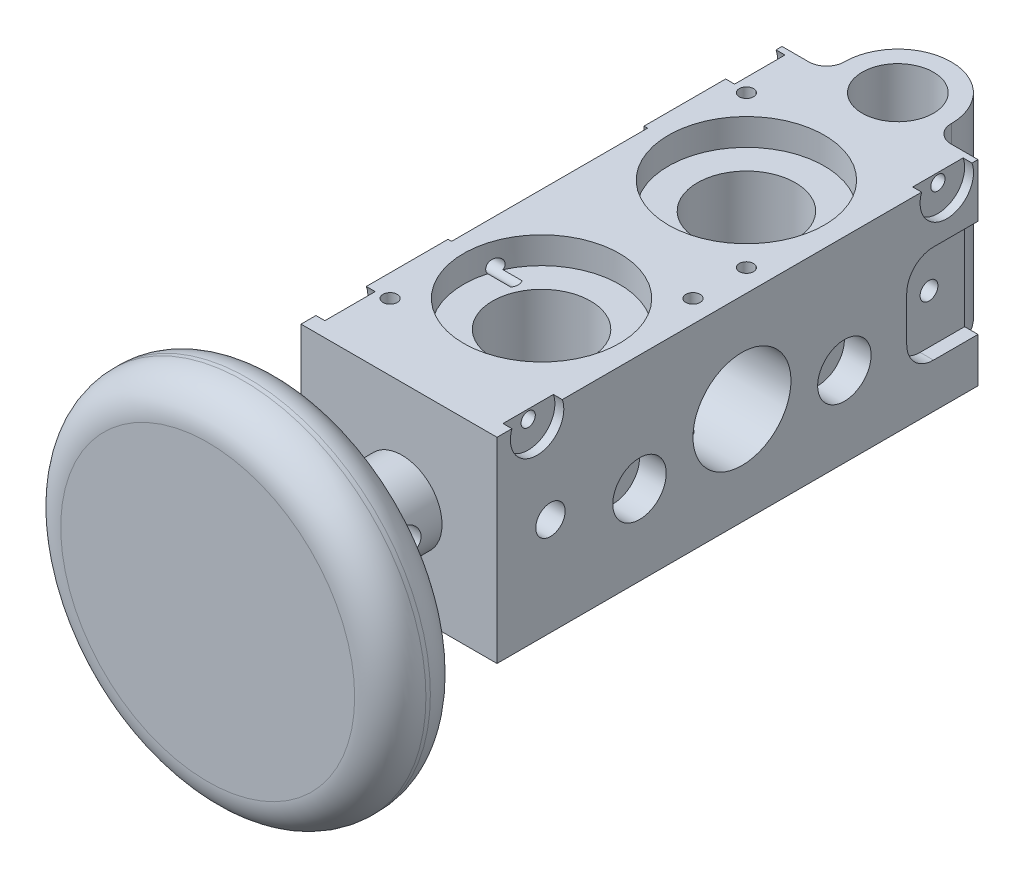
SolidWorks part; units mm, degrees
ref_plane "Plan de face" through (0, 0, 0) normal (0, 0, 1) x (1, 0, 0)
ref_plane "Plan de dessus" through (0, 0, 0) normal (0, 1, 0) x (1, 0, 0)
ref_plane "Plan de droite" through (0, 0, 0) normal (1, 0, 0) x (0, 0, -1)
sketch "Esquisse1" plane through (0, 0, 0) normal (0, 0, 1) x (1, 0, 0)
  line L1 (0, 0) -> (-22, 0)
  line L2 (0, 0) -> (0, 22)
  line L3 (0, 22) -> (-22, 22)
  line L4 (-22, 0) -> (-22, 22)
  dimension "D1" = 22
  dimension "D2" = 22
extrude "Extrusion1" add sketch "Esquisse1" along normal blind 54
sketch "Esquisse2" plane through (0, 0, 54) normal (0, 0, 1) x (1, 0, 0)
  circle A0 centre (-10.673, 10.4278) radius 4.5
  dimension "D1" = 9
extrude "Extrusion2" add sketch "Esquisse2" along normal blind 13
sketch "Esquisse3" plane through (0, 0, 67) normal (0, 0, 1) x (1, 0, 0)
  circle A0 centre (-10.9793, 10.2669) radius 20.5
  dimension "D1" = 41
extrude "Extrusion3" add sketch "Esquisse3" along normal blind 8.5
fillet "Congé1" radius 4 2 edges at (9.5207, 10.2669, 67) (9.5207, 10.2669, 75.5)
hole_wizard "Trou taraudé M4x0.71" positions "Esquisse8" profile "Esquisse7" tap size "M4x0.7" standard "ISO"
sketch "Esquisse8" plane through (0, 0, 0) normal (0, 1, 0) x (1, 0, 0)
  line L1 (-15.173, -54) -> (-15.173, -67) construction
  line L4 (5.5207, -67) -> (-27.4793, -67) construction
  point P1 (-10.673, -62.5)
  dimension "D1" = 4.5
  dimension "D2" = 4.5
sketch "Esquisse7" plane through (-10.673, 0, 62.5) normal (1, 0, 0) x (0, 0, -1)
  line L0 (0, 0) -> (0, 30.7669)
  line L1 (0, 30.7669) -> (1.65, 30.7669)
  line L2 (1.65, 30.7669) -> (1.65, 0)
  line L5 (1.65, 0) -> (0, 0)
  line L11 (0, -6.35) -> (0, 107.95) construction
  dimension "Diamètre du trou pour taraudage jusqu'au prochain" = 3.3
  dimension "Profondeur du trou pour taraudage jusqu'au prochain" = 30.7669
hole_wizard "Trou taraudé M4x0.72" positions "Esquisse10" profile "Esquisse9" tap size "M4x0.7" standard "ISO"
sketch "Esquisse10" plane through (0, 0, 0) normal (1, 0, 0) x (0, 0, -1)
  line L0 (-54, 14.9278) -> (-60.85, 14.9278) construction
  line L1 (-67, -6.2331) -> (-67, 26.7669) construction
  point P1 (-58, 10.4278)
  dimension "D1" = 4.5
  dimension "D2" = 9
sketch "Esquisse9" plane through (0, 10.4278, 58) normal (0, 1, 0) x (0, 0, -1)
  line L0 (0, 0) -> (0, 31.4793)
  line L1 (0, 31.4793) -> (1.65, 31.4793)
  line L2 (1.65, 31.4793) -> (1.65, 0)
  line L5 (1.65, 0) -> (0, 0)
  line L11 (0, -6.35) -> (0, 107.95) construction
  dimension "Diamètre du trou pour taraudage jusqu'au prochain" = 3.3
  dimension "Profondeur du trou pour taraudage jusqu'au prochain" = 31.4793
hole_wizard "Trou taraudé M4x0.73" positions "Esquisse12" profile "Esquisse11" tap size "M4x0.7" standard "ISO"
sketch "Esquisse12" plane through (0, 0, 0) normal (1, 0, 0) x (0, 0, -1)
  line L0 (-54, 22) -> (0, 22) construction
  line L1 (-54, 0) -> (-54, 22) construction
  point P0 (-48, 11)
  dimension "D1" = 11
  dimension "D2" = 6
sketch "Esquisse11" plane through (0, 11, 48) normal (0, 1, 0) x (0, 0, -1)
  line L0 (0, 0) -> (0, 11.0914)
  line L1 (0, 11.0914) -> (1.65, 10.1)
  line L2 (1.65, 10.1) -> (1.65, 0)
  line L5 (1.65, 0) -> (0, 0)
  line L10 (0, 11.0914) -> (-1.65, 10.1) construction
  line L11 (0, -6.35) -> (0, 107.95) construction
  dimension "Diamètre du trou pour taraudage" = 3.3
  dimension "Profondeur du trou pour taraudage" = 10.1
  dimension "Angle de pointe" = 118
hole_wizard "Trou taraudé M4x0.74" positions "Esquisse14" profile "Esquisse13" tap size "M4x0.7" standard "ISO"
sketch "Esquisse14" plane through (0, 0, 0) normal (0, -1, 0) x (1, 0, 0)
  line L0 (0, 54) -> (0, 0) construction
  line L1 (-22, 54) -> (0, 54) construction
  point P0 (-11, 51)
  dimension "D1" = 11
  dimension "D2" = 3
sketch "Esquisse13" plane through (-11, 0, 51) normal (1, 0, 0) x (0, 0, -1)
  line L0 (0, 0) -> (0, 11.0914)
  line L1 (0, 11.0914) -> (1.65, 10.1)
  line L2 (1.65, 10.1) -> (1.65, 0)
  line L5 (1.65, 0) -> (0, 0)
  line L10 (0, 11.0914) -> (-1.65, 10.1) construction
  line L11 (0, -6.35) -> (0, 107.95) construction
  dimension "Diamètre du trou pour taraudage" = 3.3
  dimension "Profondeur du trou pour taraudage" = 10.1
  dimension "Angle de pointe" = 118
sketch "Esquisse15" plane through (0, 0, 0) normal (0, -1, 0) x (1, 0, 0)
  line L0 (0, 54) -> (0, 0) construction
  line L1 (-22, 0) -> (0, 0) construction
  circle A0 centre (-11, -2) radius 6
  dimension "D3" = 12
  dimension "D1" = 11
  dimension "D2" = 2
extrude "Extrusion4" add sketch "Esquisse15" against normal up to surface (22 mm away)
fillet "Congé2" radius 2 2 edges at (-5.3431, 11, 0) (-16.6569, 11, 0)
sketch "Esquisse16" plane through (0, 0, 0) normal (0, -1, 0) x (1, 0, 0)
  circle A0 centre (-11, -2) radius 4
  arc A1 (-17, -2) -> (-5, -2) centre (-11, -2) ccw construction
  dimension "D1" = 8
extrude "Enlèv. mat.-Extru.1" cut sketch "Esquisse16" against normal through all
sketch "Esquisse22" plane through (-22, 0, 0) normal (-1, 0, 0) x (0, 0, 1)
  line L0 (0, 22) -> (0, 0) construction
  line L1 (54, 0) -> (0, 0) construction
  circle A0 centre (26.5, 11) radius 8.75
  dimension "D1" = 17.5
  dimension "D2" = 26.5
  dimension "D3" = 11
extrude "Enlèv. mat.-Extru.5" cut sketch "Esquisse22" against normal blind 3
sketch "Esquisse32" plane through (-19, 0, 0) normal (-1, 0, 0) x (0, 0, 1)
  circle A0 centre (26.5, 11) radius 5.5
  circle A1 centre (26.5, 11) radius 8.75 construction
  dimension "D1" = 11
sketch "Esquisse17" plane through (0, 22, 0) normal (0, 1, 0) x (-1, 0, 0)
  line L0 (0, 54) -> (0, 0) construction
  line L1 (0, 54) -> (22, 54) construction
  circle A0 centre (11, 38) radius 8.75
  dimension "D1" = 17.5
  dimension "D2" = 11
  dimension "D3" = 16
extrude "Enlèv. mat.-Extru.2" cut sketch "Esquisse17" against normal blind 3
sketch "Esquisse18" plane through (0, 19, 0) normal (0, 1, 0) x (-1, 0, 0)
  circle A0 centre (11, 38) radius 5.5
  circle A1 centre (11, 38) radius 8.75 construction
  dimension "D1" = 11
extrude "Enlèv. mat.-Extru.3" cut sketch "Esquisse18" against normal through all
sketch "Esquisse19" plane through (0, 0, 0) normal (1, 0, 0) x (0, 0, -1)
  line L1 (-54, 0) -> (-54, 22) construction
  line L2 (-54, 0) -> (0, 0) construction
  circle A0 centre (-38, 9) radius 3
  dimension "D3" = 6
  dimension "D1" = 16
  dimension "D2" = 9
extrude "Enlèv. mat.-Extru.4" cut sketch "Esquisse19" against normal blind 3
hole_wizard "Trou taraudé M2x0.42" positions "Esquisse21" profile "Esquisse20" tap size "M2x0.4" standard "ISO"
sketch "Esquisse21" plane through (-3, 0, 0) normal (1, 0, 0) x (0, 0, -1)
  circle A0 centre (-38, 9) radius 3 construction
  point P0 (-38, 9)
sketch "Esquisse20" plane through (-3, 9, 38) normal (0, 1, 0) x (0, 0, -1)
  line L0 (0, 0) -> (0, 19)
  line L1 (0, 19) -> (0.8, 19)
  line L2 (0.8, 19) -> (0.8, 0)
  line L5 (0.8, 0) -> (0, 0)
  line L11 (0, -6.35) -> (0, 107.95) construction
  dimension "Diamètre du trou pour taraudage jusqu'au prochain" = 1.6
  dimension "Profondeur du trou pour taraudage jusqu'au prochain" = 19
pattern_linear "Répétition linéaire1" count 2 spacing 23 along (0, 0, -1) of "Enlèv. mat.-Extru.2", "Enlèv. mat.-Extru.3", "Enlèv. mat.-Extru.4", "Trou taraudé M2x0.42"
sketch "Esquisse29" plane through (0, 0, 0) normal (0, -1, 0) x (1, 0, 0)
  line L0 (0, 54) -> (0, 0) construction
  line L2 (-22, 0) -> (-19, 0) construction
  circle A0 centre (-6.5, 26.5) radius 3
  dimension "D1" = 6
  dimension "D2" = 6.5
  dimension "D3" = 26.5
extrude "Enlèv. mat.-Extru.13" cut sketch "Esquisse29" against normal blind 3
hole_wizard "Trou taraudé M2x0.41" positions "Esquisse31" profile "Esquisse30" tap size "M2x0.4" standard "ISO"
sketch "Esquisse31" plane through (0, 3, 0) normal (0, -1, 0) x (1, 0, 0)
  circle A0 centre (-6.5, 26.5) radius 3 construction
  point P0 (-6.5, 26.5)
sketch "Esquisse30" plane through (-6.5, 3, 26.5) normal (1, 0, 0) x (0, 0, -1)
  line L0 (0, 0) -> (0, 5.6807)
  line L1 (0, 5.6807) -> (0.8, 5.2)
  line L2 (0.8, 5.2) -> (0.8, 0)
  line L5 (0.8, 0) -> (0, 0)
  line L10 (0, 5.6807) -> (-0.8, 5.2) construction
  line L11 (0, -6.35) -> (0, 107.95) construction
  dimension "Diamètre du trou pour taraudage" = 1.6
  dimension "Profondeur du trou pour taraudage" = 5.2
  dimension "Angle de pointe" = 118
pattern_linear "Répétition linéaire2" count 2 spacing 7 along (-1, 0, 0) of "Enlèv. mat.-Extru.13", "Trou taraudé M2x0.41"
hole_wizard "Trou taraudé M2x0.43" positions "Esquisse34" profile "Esquisse33" tap size "M2x0.4" standard "ISO"
sketch "Esquisse34" plane through (0, 22, 0) normal (0, 1, 0) x (-1, 0, 0)
  circle A0 centre (11, 15) radius 8.75 construction
  circle A1 centre (11, 38) radius 8.75 construction
  point P0 (19.5, 6.5)
  point P4 (2.5, 23.5)
  point P6 (2.5, 29.5)
  point P8 (19.5, 46.5)
  dimension "D1" = 8.5
  dimension "D3" = 8.5
  dimension "D4" = 8.5
  dimension "D6" = 8.5
  dimension "D8" = 8.5
  dimension "D2" = 8.5
  dimension "D5" = 8.5
  dimension "D7" = 8.5
sketch "Esquisse33" plane through (-19.5, 22, 6.5) normal (1, 0, 0) x (0, 0, 1)
  line L0 (0, 0) -> (0, 5.6807)
  line L1 (0, 5.6807) -> (0.8, 5.2)
  line L2 (0.8, 5.2) -> (0.8, 0)
  line L5 (0.8, 0) -> (0, 0)
  line L10 (0, 5.6807) -> (-0.8, 5.2) construction
  line L11 (0, -6.35) -> (0, 107.95) construction
  dimension "Diamètre du trou pour taraudage" = 1.6
  dimension "Profondeur du trou pour taraudage" = 5.2
  dimension "Angle de pointe" = 118
hole_wizard "Trou taraudé M2x0.44" positions "Esquisse36" profile "Esquisse35" tap size "M2x0.4" standard "ISO"
sketch "Esquisse36" plane through (-22, 0, 0) normal (-1, 0, 0) x (0, 0, 1)
  circle A0 centre (26.5, 11) radius 8.75 construction
  point P0 (35, 19.5)
  point P1 (18, 2.5)
  dimension "D2" = 8.5
  dimension "D1" = 8.5
  dimension "D3" = 8.5
  dimension "D4" = 8.5
sketch "Esquisse35" plane through (-22, 19.5, 35) normal (0, 1, 0) x (0, 0, 1)
  line L0 (0, 0) -> (0, 5.6807)
  line L1 (0, 5.6807) -> (0.8, 5.2)
  line L2 (0.8, 5.2) -> (0.8, 0)
  line L5 (0.8, 0) -> (0, 0)
  line L10 (0, 5.6807) -> (-0.8, 5.2) construction
  line L11 (0, -6.35) -> (0, 107.95) construction
  dimension "Diamètre du trou pour taraudage" = 1.6
  dimension "Profondeur du trou pour taraudage" = 5.2
  dimension "Angle de pointe" = 118
extrude "Enlèv. mat.-Extru.16" cut sketch "Esquisse32" against normal through all
sketch "Esquisse37" plane through (-22, 0, 0) normal (-1, 0, 0) x (0, 0, 1)
  line L0 (54, 22) -> (0, 22) construction
  line L1 (15.5, 22) -> (37.5, 22)
  line L2 (15.5, 22) -> (15.5, 0)
  line L3 (15.5, 0) -> (37.5, 0)
  line L4 (37.5, 22) -> (37.5, 0)
  line L5 (54, 0) -> (0, 0) construction
  circle A0 centre (26.5, 11) radius 8.75 construction
  dimension "D1" = 11
  dimension "D2" = 11
extrude "Enlèv. mat.-Extru.17" cut sketch "Esquisse37" against normal blind 0.4
sketch "Esquisse38" plane through (0, 0, 0) normal (0, -1, 0) x (1, 0, 0)
  line L0 (-22, 54) -> (-22, 37.5) construction
  circle A0 centre (-21, 38) radius 3
  circle A1 centre (-13.5, 26.5) radius 3 construction
  dimension "D1" = 6
  dimension "D2" = 1
  dimension "D3" = 11.5
extrude "Enlèv. mat.-Extru.18" cut sketch "Esquisse38" against normal blind 1
hole_wizard "Trou taraudé M2x0.45" positions "Esquisse40" profile "Esquisse39" tap size "M2x0.4" standard "ISO"
sketch "Esquisse40" plane through (0, 1, 0) normal (0, -1, 0) x (1, 0, 0)
  arc A0 (-21.6, 35.0606) -> (-22, 40.8284) centre (-21, 38) ccw construction
  point P0 (-21, 38)
sketch "Esquisse39" plane through (-21, 1, 38) normal (1, 0, 0) x (0, 0, -1)
  line L0 (0, 0) -> (0, 5.6807)
  line L1 (0, 5.6807) -> (0.8, 5.2)
  line L2 (0.8, 5.2) -> (0.8, 0)
  line L5 (0.8, 0) -> (0, 0)
  line L10 (0, 5.6807) -> (-0.8, 5.2) construction
  line L11 (0, -6.35) -> (0, 107.95) construction
  dimension "Diamètre du trou pour taraudage" = 1.6
  dimension "Profondeur du trou pour taraudage" = 5.2
  dimension "Angle de pointe" = 118
pattern_linear "Répétition linéaire3" count 2 spacing 23 along (0, 0, -1) of "Trou taraudé M2x0.45", "Enlèv. mat.-Extru.18"
sketch "Esquisse41" plane through (-22, 0, 0) normal (-1, 0, 0) x (0, 0, 1)
  line L0 (15.5, 22) -> (0, 22) construction
  circle A0 centre (3.5, 21) radius 3
  circle A1 centre (15, 9) radius 3 construction
  dimension "D1" = 6
  dimension "D2" = 1
  dimension "D3" = 11.5
extrude "Enlèv. mat.-Extru.19" cut sketch "Esquisse41" against normal blind 1
hole_wizard "Trou taraudé M2x0.46" positions "Esquisse43" profile "Esquisse42" tap size "M2x0.4" standard "ISO"
sketch "Esquisse43" plane through (-21, 0, 0) normal (-1, 0, 0) x (0, 0, 1)
  arc A0 (0.6716, 22) -> (6.3284, 22) centre (3.5, 21) ccw construction
  point P0 (3.5, 21)
sketch "Esquisse42" plane through (-21, 21, 3.5) normal (0, 1, 0) x (0, 0, 1)
  line L0 (0, 0) -> (0, 5.6807)
  line L1 (0, 5.6807) -> (0.8, 5.2)
  line L2 (0.8, 5.2) -> (0.8, 0)
  line L5 (0.8, 0) -> (0, 0)
  line L10 (0, 5.6807) -> (-0.8, 5.2) construction
  line L11 (0, -6.35) -> (0, 107.95) construction
  dimension "Diamètre du trou pour taraudage" = 1.6
  dimension "Profondeur du trou pour taraudage" = 5.2
  dimension "Angle de pointe" = 118
pattern_linear "Répétition linéaire4" count 2 spacing 46 along (0, 0, 1) of "Enlèv. mat.-Extru.19", "Trou taraudé M2x0.46"
ref_plane "Plan1" through (-11, 0, 0) normal (1, 0, 0) x (0, 0, -1)
mirror "Symétrie1" about plane through (-11, 0, 0) normal (1, 0, 0) of "Répétition linéaire4", "Enlèv. mat.-Extru.19", "Trou taraudé M2x0.46"
sketch "Esquisse44" plane through (0, 0, 0) normal (1, 0, 0) x (0, 0, -1)
  line L0 (-5, 16) -> (0, 16)
  line L1 (-8, 13) -> (-8, 8)
  line L2 (-5, 5) -> (0, 5)
  line L3 (0, 16) -> (0, 5)
  arc A0 (-8, 13) -> (-5, 16) centre (-5, 13) cw
  arc A1 (-8, 8) -> (-5, 5) centre (-5, 8) ccw
  dimension "D1" = 3
  dimension "D2" = 5
  dimension "D3" = 8
  dimension "D4" = 11
extrude "Enlèv. mat.-Extru.20" cut sketch "Esquisse44" against normal blind 1.5
sketch "Esquisse46" plane through (-22, 0, 0) normal (-1, 0, 0) x (0, 0, 1)
  line L0 (0, 6) -> (0, 17)
  line L1 (0, 17) -> (5, 17)
  line L2 (8, 14) -> (8, 9)
  line L3 (5, 6) -> (0, 6)
  arc A0 (8, 14) -> (5, 17) centre (5, 14) ccw
  arc A1 (8, 9) -> (5, 6) centre (5, 9) cw
  dimension "D1" = 3
  dimension "D2" = 5
  dimension "D3" = 11
  dimension "D4" = 8
extrude "Enlèv. mat.-Extru.21" cut sketch "Esquisse46" against normal blind 1.5
hole_wizard "Trou taraudé M2x0.410" positions "Esquisse67" profile "Esquisse66" tap size "M2x0.4" standard "ISO"
sketch "Esquisse67" plane through (-20.5, 0, 0) normal (-1, 0, 0) x (0, 0, 1)
  line L0 (5, 17) -> (0, 17) construction
  line L1 (0, 17) -> (0, 6) construction
  point P0 (4, 11.5)
  dimension "D1" = 5.5
  dimension "D2" = 4
sketch "Esquisse66" plane through (-20.5, 11.5, 4) normal (0, 1, 0) x (0, 0, 1)
  line L0 (0, 0) -> (0, 5.9807)
  line L1 (0, 5.9807) -> (0.8, 5.5)
  line L2 (0.8, 5.5) -> (0.8, 6)
  line L3 (0.8, 6) -> (1, 6)
  line L4 (1, 6) -> (1, 0)
  line L5 (1, 0) -> (0, 0)
  line L10 (0, 5.9807) -> (-0.8, 5.5) construction
  line L11 (0, -6.35) -> (0, 107.95) construction
  dimension "Diamètre du trou pour taraudage" = 1.6
  dimension "Profondeur du trou pour taraudage" = 5.5
  dimension "Diamètre principal du filetage" = 2
  dimension "Profondeur du filetage" = 6
  dimension "Angle de pointe" = 118
hole_wizard "Trou taraudé M2x0.412" positions "Esquisse74" profile "Esquisse73" tap size "M2x0.4" standard "ISO"
sketch "Esquisse74" plane through (-1.5, 0, 0) normal (1, 0, 0) x (0, 0, -1)
  line L0 (-5, 5) -> (0, 5) construction
  line L1 (0, 5) -> (0, 16) construction
  point P0 (-4, 10.5)
  dimension "D1" = 5.5
  dimension "D2" = 4
sketch "Esquisse73" plane through (-1.5, 10.5, 4) normal (0, 1, 0) x (0, 0, -1)
  line L0 (0, 0) -> (0, 7.6807)
  line L1 (0, 7.6807) -> (0.8, 7.2)
  line L2 (0.8, 7.2) -> (0.8, 6)
  line L3 (0.8, 6) -> (1, 6)
  line L4 (1, 6) -> (1, 0)
  line L5 (1, 0) -> (0, 0)
  line L10 (0, 7.6807) -> (-0.8, 7.2) construction
  line L11 (0, -6.35) -> (0, 107.95) construction
  dimension "Diamètre du trou pour taraudage" = 1.6
  dimension "Profondeur du trou pour taraudage" = 7.2
  dimension "Diamètre principal du filetage" = 2
  dimension "Profondeur du filetage" = 6
  dimension "Angle de pointe" = 118
